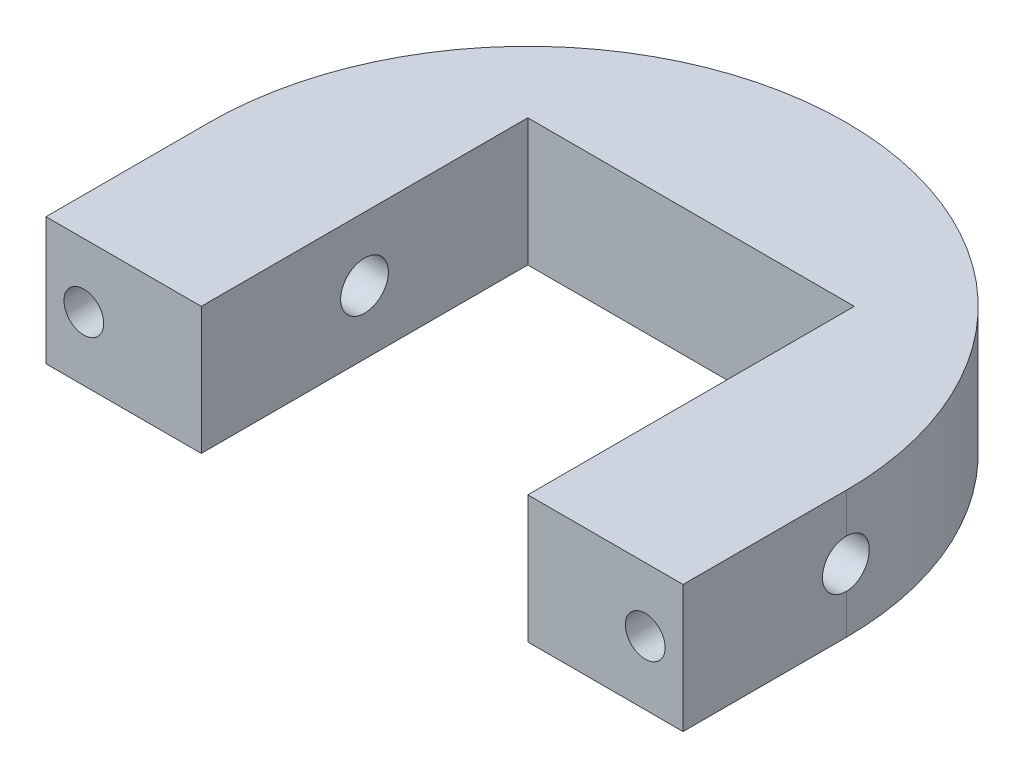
SolidWorks part; units mm, degrees
ref_plane "Front Plane" through (0, 0, 0) normal (0, 0, 1) x (1, 0, 0)
ref_plane "Top Plane" through (0, 0, 0) normal (0, 1, 0) x (1, 0, 0)
ref_plane "Right Plane" through (0, 0, 0) normal (1, 0, 0) x (0, 0, -1)
sketch "Sketch1" plane through (0, 0, 0) normal (0, 1, 0) x (1, 0, 0)
  circle A3 centre (0, 0) radius 40
extrude "Boss-Extrude1" add sketch "Sketch1" along normal blind 16
sketch "Sketch2" plane through (0, 16, 0) normal (0, 1, 0) x (1, 0, 0)
  line L1 (20.5, -20.5) -> (-20.5, -20.5)
  line L2 (20.5, -20.5) -> (20.5, 20.5)
  line L3 (20.5, 20.5) -> (-20.5, 20.5)
  line L4 (-20.5, -20.5) -> (-20.5, 20.5)
  point P4 (0, 0)
  dimension "D1" = 41
  dimension "D2" = 20.5
  dimension "D3" = 20.5
extrude "Cut-Extrude1" cut sketch "Sketch2" against normal through all
ref_plane "Plane1" through (0, 0, 0) normal (-1, 0, 0) x (0, 0, 1)
sketch "Sketch13" plane through (0, 0, 20.5) normal (0, 0, -1) x (-1, 0, 0)
  line L1 (-30.5, 31) -> (30.5, 31)
  line L2 (-30.5, 31) -> (-30.5, -15)
  line L3 (-30.5, -15) -> (30.5, -15)
  line L4 (30.5, 31) -> (30.5, -15)
  line L6 (20.5, 0) -> (20.5, 16) construction
  line L7 (-20.5, 0) -> (-20.5, 16) construction
  line L8 (20.5, 0) -> (-20.5, 0) construction
  line L9 (20.5, 16) -> (-20.5, 16) construction
  dimension "D1" = 10
  dimension "D2" = 10
  dimension "D3" = 15
  dimension "D4" = 15
extrude "Boss-Extrude4" add sketch "Sketch13" against normal blind 75
sketch "Sketch14" plane through (0, 31, 0) normal (0, 1, 0) x (1, 0, 0)
  line L0 (-30.5, -95.5) -> (30.5, -95.5) construction
  line L1 (24.5, -95.5) -> (-24.5, -95.5)
  line L2 (24.5, -95.5) -> (24.5, -28.5)
  line L3 (24.5, -28.5) -> (-24.5, -28.5)
  line L4 (-24.5, -95.5) -> (-24.5, -28.5)
  line L5 (30.5, -95.5) -> (30.5, -20.5) construction
  line L6 (-30.5, -95.5) -> (-30.5, -20.5) construction
  line L7 (-30.5, -20.5) -> (30.5, -20.5) construction
  dimension "D1" = 6
  dimension "D2" = 6
  dimension "D3" = 8
extrude "Cut-Extrude2" cut sketch "Sketch14" against normal blind 35
sketch "Sketch15" plane through (0, -4, 0) normal (0, 1, 0) x (1, 0, 0)
  line L0 (24.5, -95.5) -> (24.5, -28.5) construction
  line L1 (-24.5, -28.5) -> (24.5, -28.5)
  line L2 (-24.5, -28.5) -> (-24.5, -89.5)
  line L3 (-24.5, -89.5) -> (24.5, -89.5)
  line L4 (24.5, -28.5) -> (24.5, -89.5)
  line L5 (-24.5, -95.5) -> (24.5, -95.5) construction
  dimension "D1" = 6
extrude "Cut-Extrude3" cut sketch "Sketch15" against normal blind 5
fillet "Fillet1" radius 10 2 edges at (27.5, 31, 95.5) (-27.5, 31, 95.5)
fillet "Fillet2" radius 5 4 edges at (0, -9, 89.5) (0, -15, 95.5) (0, -15, 20.5) (0, -9, 28.5)
sketch "Sketch17" plane through (0, 16, 0) normal (0, 1, 0) x (1, 0, 0)
  circle A0 centre (0, 0) radius 41
  dimension "D1" = 82
extrude "Cut-Extrude5" cut sketch "Sketch17" along normal up to next
sketch "Sketch18" plane through (0, 16, 0) normal (0, 1, 0) x (1, 0, 0)
  line L0 (-20.5, 20.5) -> (-20.5, -20.5) construction
  line L1 (20.5, -20.5) -> (20.5, 20.5) construction
  line L2 (-20.5, -20.5) -> (20.5, -20.5) construction
  line L3 (-20.5, 20.5) -> (-20.5, -20.5) construction
  line L4 (20.5, -20.5) -> (20.5, 20.5) construction
  line L5 (-20.5, -20.5) -> (20.5, -20.5) construction
  line L6 (40, 0) -> (20.5, 0) construction
  line L8 (20.5, 0) -> (20.5, -20.5)
  line L9 (20.5, -20.5) -> (-20.5, -20.5)
  line L10 (-20.5, 0) -> (-20.5, -20.5)
  line L11 (40, 0) -> (20.5, 0)
  line L12 (40, 0) -> (40, -32.8748)
  line L13 (40, -32.8748) -> (24.5, -32.8748)
  line L14 (-40, 0) -> (-40, -32.8748)
  line L15 (24.5, -32.8748) -> (24.5, -28.5) construction
  line L16 (24.5, -28.5) -> (-24.5, -28.5) construction
  line L17 (-24.5, -28.5) -> (-24.5, -32.8748) construction
  line L18 (-24.5, -28.5) -> (-24.5, -32.8748)
  line L19 (24.5, -28.5) -> (-24.5, -28.5)
  line L20 (24.5, -32.8748) -> (24.5, -28.5)
  line L21 (-20.5, 0) -> (-40, 0)
  line L22 (-20.5, 0) -> (-40, 0) construction
  line L23 (-24.5, -32.8748) -> (-40, -32.8748)
  arc A0 (30.5, -25.8795) -> (-30.5, -25.8795) centre (0, 0) ccw construction
extrude "Boss-Extrude5" add sketch "Sketch18" against normal up to surface (16 mm away)
sketch "Sketch16" plane through (20.5, 0, 0) normal (-1, 0, 0) x (0, 0, 1)
  line L0 (20.5, 16) -> (-20.5, 16) construction
  line L2 (-20.5, 0) -> (-20.5, 16) construction
  circle A0 centre (0, 8) radius 3
  dimension "D1" = 6
  dimension "D2" = 8
  dimension "D3" = 20.5
extrude "Cut-Extrude4" cut sketch "Sketch16" against normal through all and the other way through all
sketch "Sketch19" plane through (0, 0, 32.8748) normal (0, 0, 1) x (1, 0, 0)
  line L0 (-40, 0) -> (-40, 16) construction
  line L1 (-40, 16) -> (-30.5, 16) construction
  line L2 (30.5, 16) -> (40, 16) construction
  line L3 (40, 0) -> (40, 16) construction
  point P0 (-35.25, 8)
  point P1 (35.25, 8)
  dimension "D1" = 4.75
  dimension "D2" = 8
  dimension "D3" = 8
  dimension "D4" = 4.75
hole_wizard "Ø5.0mm Dowel Hole1" positions "3DSketch1" profile "Sketch20" hole size "Ø5.0" standard "ANSI Metric"
sketch3d "3DSketch1"
  point P0 (-35.25, 8, 32.8748)
  point P3 (35.25, 8, 32.8748)
sketch "Sketch20" plane through (-35.25, 8, 32.8748) normal (1, 0, 0) x (0, -1, 0)
  line L0 (0, 0) -> (0, 26.5022)
  line L1 (0, 26.5022) -> (2.5, 25)
  line L2 (2.5, 25) -> (2.5, 0)
  line L5 (2.5, 0) -> (0, 0)
  line L10 (0, 26.5022) -> (-2.5, 25) construction
  line L11 (0, -6.35) -> (0, 107.95) construction
  dimension "Hole Dia." = 5
  dimension "Hole Depth" = 25
  dimension "Drill Angle" = 118
sketch "Sketch21" plane through (0, 16, 0) normal (0, 1, 0) x (1, 0, 0)
  line L0 (40, -32.8748) -> (40, 0) construction
  line L1 (-24.5, -95.5) -> (24.5, -95.5) construction
  line L2 (-40, 0) -> (-40, -32.8748) construction
  line L3 (20.5, -20.5) -> (20.5, 20.5) construction
  line L4 (40, -32.8748) -> (40, 0) construction
  line L5 (-24.5, -95.5) -> (24.5, -95.5) construction
  line L6 (-40, 0) -> (-40, -32.8748) construction
  line L7 (20.5, -20.5) -> (20.5, 20.5) construction
  line L8 (-20.5, -20.5) -> (20.5, -20.5) construction
  line L9 (40, -20.5) -> (-40, -20.5)
  line L10 (40, -20.5) -> (40, -95.5)
  line L11 (40, -95.5) -> (-40, -95.5)
  line L12 (-40, -20.5) -> (-40, -95.5)
extrude "Cut-Extrude6" cut sketch "Sketch21" against normal through all and the other way through all
